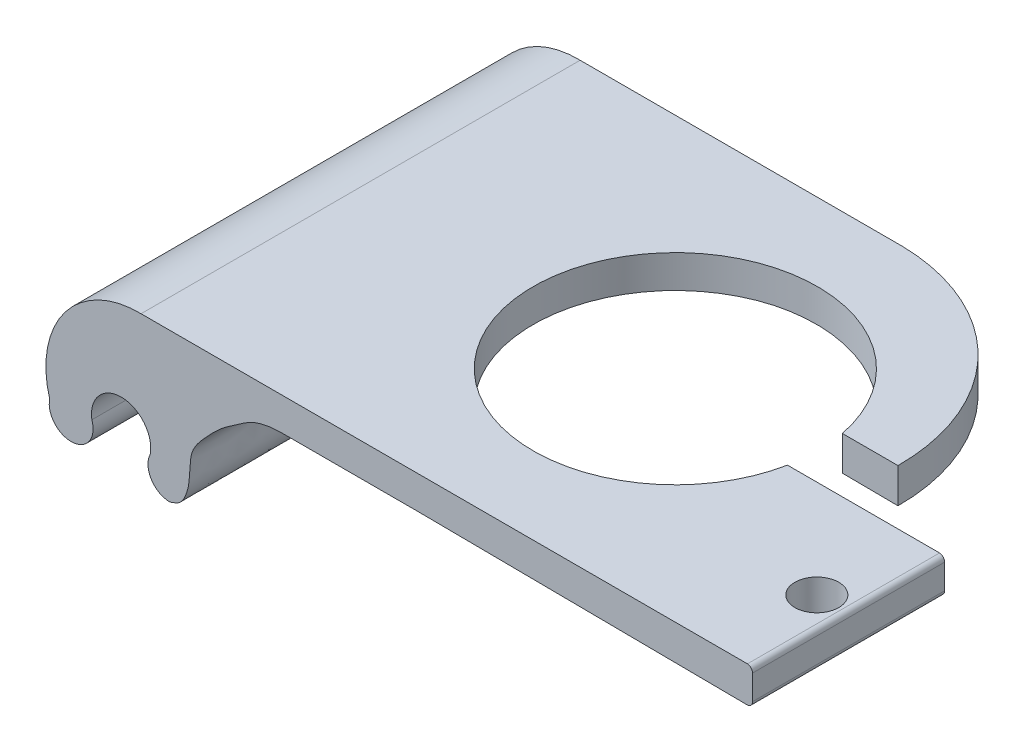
SolidWorks part; units mm, degrees
ref_plane "Спереди" through (0, 0, 0) normal (0, 0, 1) x (1, 0, 0)
ref_plane "Сверху" through (0, 0, 0) normal (0, 1, 0) x (1, 0, 0)
ref_plane "Справа" through (0, 0, 0) normal (1, 0, 0) x (0, 0, -1)
sketch "Эскиз1" plane through (0, 0, 0) normal (0, 0, 1) x (1, 0, 0)
  line L1 (-33.0312, 18.2629) -> (-33.0312, 6.3088) construction
  line L2 (-58.2153, 13.5181) -> (-2.9675, 13.5181)
  line L4 (-33.0312, 10.5256) -> (-45.5393, 10.5256)
  line L6 (-33.0312, 10.5256) -> (-3.0121, 10.265)
  line L7 (-2.5077, 10.7649) -> (-2.5077, 13.0198)
  arc A0 (-55.5749, -0.0256) -> (-57.3737, 2.8639) centre (-55.5824, 1.9744) cw
  arc A2 (-57.3737, 2.8639) -> (-62.6962, 2.9084) centre (-60.0312, 3.3414) ccw
  arc A3 (-62.6962, 2.9084) -> (-66.5439, 2.6338) centre (-64.5824, 2.2434) cw
  arc A4 (-66.5439, 2.6338) -> (-58.2153, 13.5181) centre (-58.3857, 5.0199) cw
  arc A11 (-2.5077, 13.0198) -> (-2.9675, 13.5181) centre (-3.0077, 13.0198) ccw
  arc A12 (-3.0121, 10.265) -> (-2.5077, 10.7649) centre (-3.0077, 10.7649) ccw
  spline S0 degree 3 poles (-45.5393, 10.5256) (-47.7253, 10.4455) (-48.5396, 9.7767) (-50.775, 8.2535) (-51.4352, 7.7218) (-53.5465, 5.3238) (-53.7616, 4.1939) (-53.8026, 2.5397) (-53.9994, 1.583) (-54.4486, 0.2823) (-55.3269, 0.0717) (-55.5749, -0.0256) knots 0 0 0 0 0.263205 0.312704 0.47474 0.50695 0.614547 0.712669 0.731664 0.804503 0.864133 0.864133 0.864133 0.864133
  point P6 (0, 0)
  point P31 (-33.0312, 13.1159)
  dimension "D1" = 27
  dimension "D3" = 2
  dimension "D4" = 2
  dimension "D6" = 8.5
  dimension "D2" = 2.7
  dimension "D5" = 9
extrude "Бобышка-Вытянуть1" add sketch "Эскиз1" along normal blind 40
sketch "Эскиз2" plane through (0, 13.5181, 0) normal (0, -1, 0) x (1, 0, 0)
  line L4 (-3.0121, 20) -> (-39.0537, 20) construction
  line L5 (-3.0121, 40) -> (-3.0121, 0) construction
  line L6 (-2.5077, 22.5) -> (-16.8254, 22.5)
  line L7 (-2.5077, 40) -> (-2.5077, 0) construction
  line L9 (-11.7568, 17.5) -> (-16.8254, 17.5)
  line L11 (-28.8114, 0) -> (-2.5077, 0)
  line L16 (-2.5077, 22.5) -> (-2.5077, 0)
  arc A0 (-16.8254, 22.5) -> (-16.8254, 17.5) centre (-29.5393, 20) ccw
  circle A3 centre (-5.2477, 31.4026) radius 2
  arc A6 (-11.7568, 17.5) -> (-28.8114, 0) centre (-29.1753, 17.4149) cw
  point P14 (-2.5077, 20)
  dimension "D2" = 2.5
extrude "Вырез-Вытянуть1" cut sketch "Эскиз2" along normal through all
sketch "Эскиз3" plane through (0, 10.5256, 0) normal (0, -1, 0) x (1, 0, 0)
  line L0 (-45.5393, 20) -> (-65.2082, 20) construction
  line L1 (-45.5393, 40) -> (-45.5393, 0) construction
  line L2 (-45.5393, 12.9128) -> (-45.5393, 27.0872)
  line L3 (-45.5393, 27.0872) -> (-66.8857, 27.0872)
  line L4 (-66.8857, 40) -> (-66.8857, 0) construction
  line L5 (-66.8857, 27.0872) -> (-66.8857, 12.9128)
  line L6 (-45.5393, 12.9128) -> (-66.8857, 12.9128)
  point P10 (-66.8857, 20)
extrude "Вырез-Вытянуть2" [suppressed] cut sketch "Эскиз3" along normal through all
